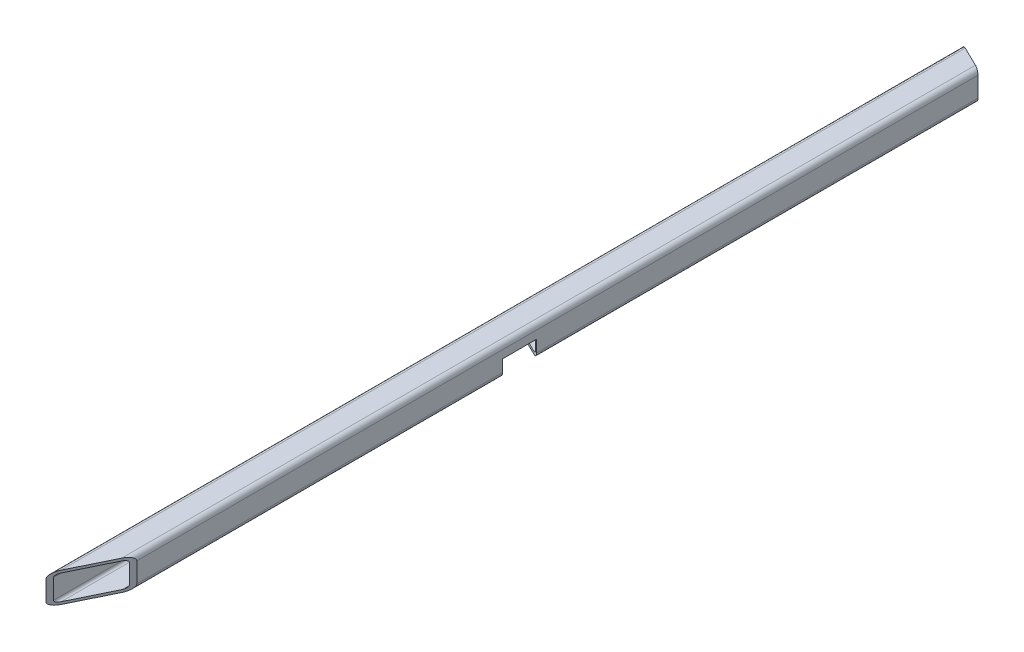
SolidWorks part; units mm, degrees
ref_plane "Plane1" through (0, 0, 0) normal (0, 0, 1) x (1, 0, 0)
ref_plane "Plane2" through (0, 0, 0) normal (0, 1, 0) x (1, 0, 0)
ref_plane "Plane3" through (0, 0, 0) normal (1, 0, 0) x (0, 0, -1)
sketch "Sketch1" plane through (0, 0, 0) normal (0, 0, 1) x (1, 0, 0)
  line L0 (-20, -25) -> (20, -25)
  line L1 (-25, -20) -> (-25, 20)
  line L2 (20, 25) -> (-20, 25)
  line L3 (25, 20) -> (25, -20)
  line L4 (-20, -30) -> (20, -30)
  line L5 (-30, -20) -> (-30, 20)
  line L6 (20, 30) -> (-20, 30)
  line L7 (30, 20) -> (30, -20)
  line L8 (-30, 0) -> (-25, 0) construction
  line L9 (-25, 0) -> (25, 0) construction
  line L10 (25, 0) -> (30, 0) construction
  line L12 (0, 30) -> (0, 25) construction
  line L13 (0, 25) -> (0, -25) construction
  line L14 (0, -25) -> (0, -30) construction
  arc A0 (30, 20) -> (20, 30) centre (20, 20) ccw
  arc A1 (20, -30) -> (30, -20) centre (20, -20) ccw
  arc A2 (-30, -20) -> (-20, -30) centre (-20, -20) ccw
  arc A3 (-20, 30) -> (-30, 20) centre (-20, 20) ccw
  arc A4 (-20, 25) -> (-25, 20) centre (-20, 20) ccw
  arc A5 (25, 20) -> (20, 25) centre (20, 20) ccw
  arc A6 (20, -25) -> (25, -20) centre (20, -20) ccw
  arc A7 (-25, -20) -> (-20, -25) centre (-20, -20) ccw
  point P2 (-30, 30)
  point P33 (-30, -30)
  point P34 (30, -30)
  point P36 (30, 30)
extrude "Extrusion1" add sketch "Sketch1" along normal blind 1847.32
sketch "Esquisse1" plane through (0, 30, 0) normal (0, 1, 0) x (-1, 0, 0)
  line L0 (-30, 1847.32) -> (30, 1847.32)
  line L1 (30, 1847.32) -> (-30, 1724.3018)
  line L2 (-30, 1724.3018) -> (-30, 1847.32)
  line L3 (-20, 1847.32) -> (20, 1847.32) construction
  line L4 (-30, 1847.32) -> (-30, 0) construction
  line L5 (30, 1847.32) -> (30, 0) construction
  dimension "D1" = 64
extrude "Extrusion2" cut sketch "Esquisse1" against normal through all
sketch "Esquisse2" plane through (0, 30, 0) normal (0, 1, 0) x (1, 0, 0)
  line L0 (-30, 0) -> (30, 0)
  line L1 (-30, 0) -> (30, -29.264)
  line L2 (30, -29.264) -> (30, 0)
  line L3 (-30, -1847.32) -> (-30, 0) construction
  line L4 (30, -1724.3018) -> (30, 0) construction
  dimension "D1" = 26
extrude "Extrusion3" cut sketch "Esquisse2" against normal through all
sketch "Esquisse4" plane through (0, -30, 0) normal (0, -1, 0) x (1, 0, 0)
  line L0 (-147.491, 901.0469) -> (94.9224, 1019.2798)
  line L1 (-147.491, 901.0469) -> (-120.312, 845.3216)
  line L2 (94.9224, 1019.2798) -> (122.1014, 963.5545)
  line L3 (-120.312, 845.3216) -> (122.1014, 963.5545)
  line L7 (20, 1744.8048) -> (-20, 1826.817) construction
  dimension "D1" = 62
  dimension "D2" = 269.7096
  dimension "D3" = 799
  dimension "D4" = 250.7095
extrude "Extrusion5" cut sketch "Esquisse4" against normal blind 34
